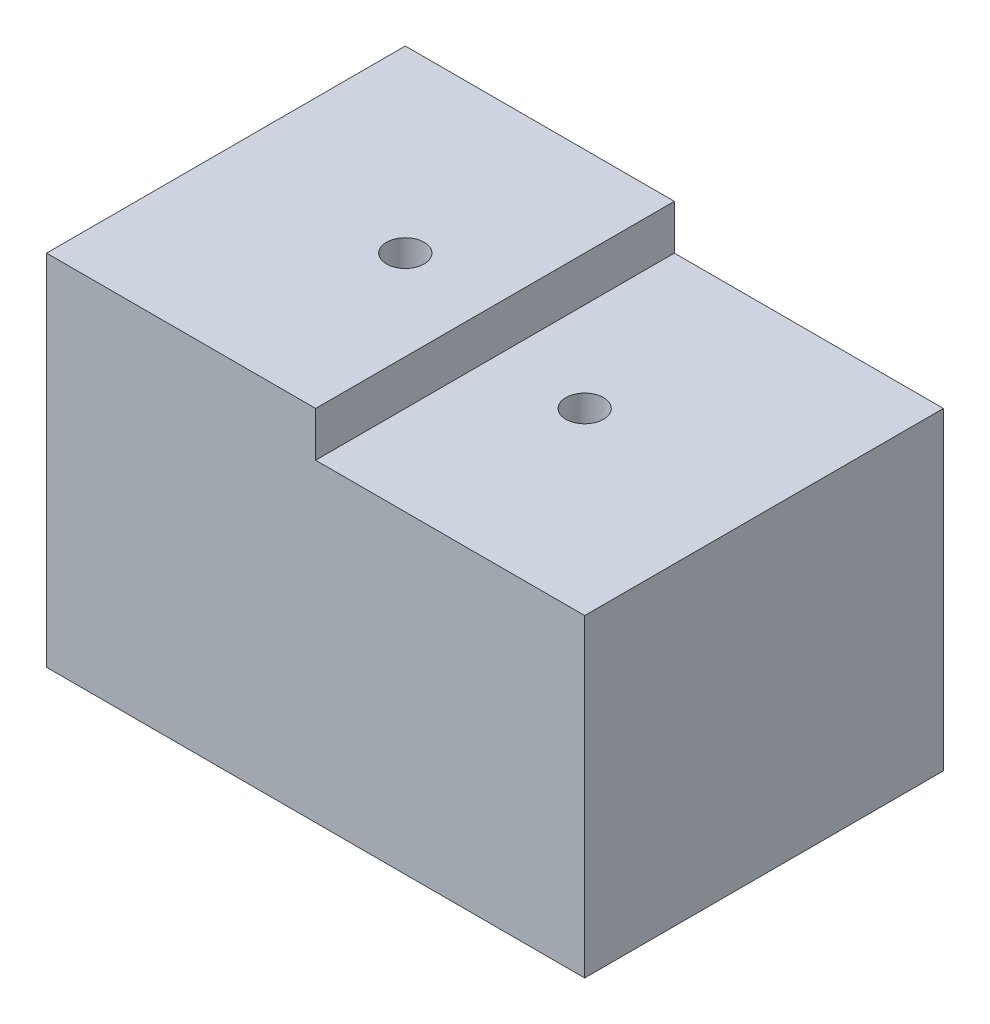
SolidWorks part; units mm, degrees
ref_plane "Vorne" through (0, 0, 0) normal (0, 0, 1) x (1, 0, 0)
ref_plane "Oben" through (0, 0, 0) normal (0, 1, 0) x (1, 0, 0)
ref_plane "Rechts" through (0, 0, 0) normal (1, 0, 0) x (0, 0, -1)
sketch "Skizze1" plane through (0, 0, 0) normal (0, 1, 0) x (1, 0, 0)
  line L1 (0, 0) -> (60, 0)
  line L2 (0, 0) -> (0, 40)
  line L3 (0, 40) -> (60, 40)
  line L4 (60, 0) -> (60, 40)
  dimension "D1" = 60
  dimension "D2" = 40
extrude "Linear austragen1" add sketch "Skizze1" along normal blind 40
hole_wizard "M5x0.8 Gewindekernloch1" positions "Skizze3" profile "Skizze2" tap size "M5x0.8" standard "DIN"
sketch "Skizze3" plane through (0, 40, 0) normal (0, 1, 0) x (-1, 0, 0)
  line L0 (0, -20) -> (-60, -20) construction
  line L1 (0, -40) -> (0, 0) construction
  line L2 (-60, 0) -> (-60, -40) construction
  point P0 (-20, -20)
  point P11 (-40, -20)
  dimension "D1" = 20
  dimension "D2" = 40
sketch "Skizze2" plane through (20, 40, -20) normal (1, 0, 0) x (0, 0, 1)
  line L0 (0, 0) -> (0, 21.2618)
  line L1 (0, 21.2618) -> (2.1, 20)
  line L2 (2.1, 20) -> (2.1, 0)
  line L5 (2.1, 0) -> (0, 0)
  line L10 (0, 21.2618) -> (-2.1, 20) construction
  line L11 (0, -6.35) -> (0, 107.95) construction
  dimension "Bohrerdurchmesser" = 4.2
  dimension "Bohrungstiefe" = 20
  dimension "Spitzenwinkel" = 118
sketch "Skizze4" plane through (0, 40, 0) normal (0, 1, 0) x (-1, 0, 0)
  line L0 (-60, -40) -> (0, -40) construction
  line L1 (-30, -40) -> (-60, -40)
  line L2 (-30, -40) -> (-30, 0)
  line L3 (-30, 0) -> (-60, 0)
  line L4 (-60, -40) -> (-60, 0)
extrude "Schnitt-Linear austragen1" cut sketch "Skizze4" against normal blind 5
